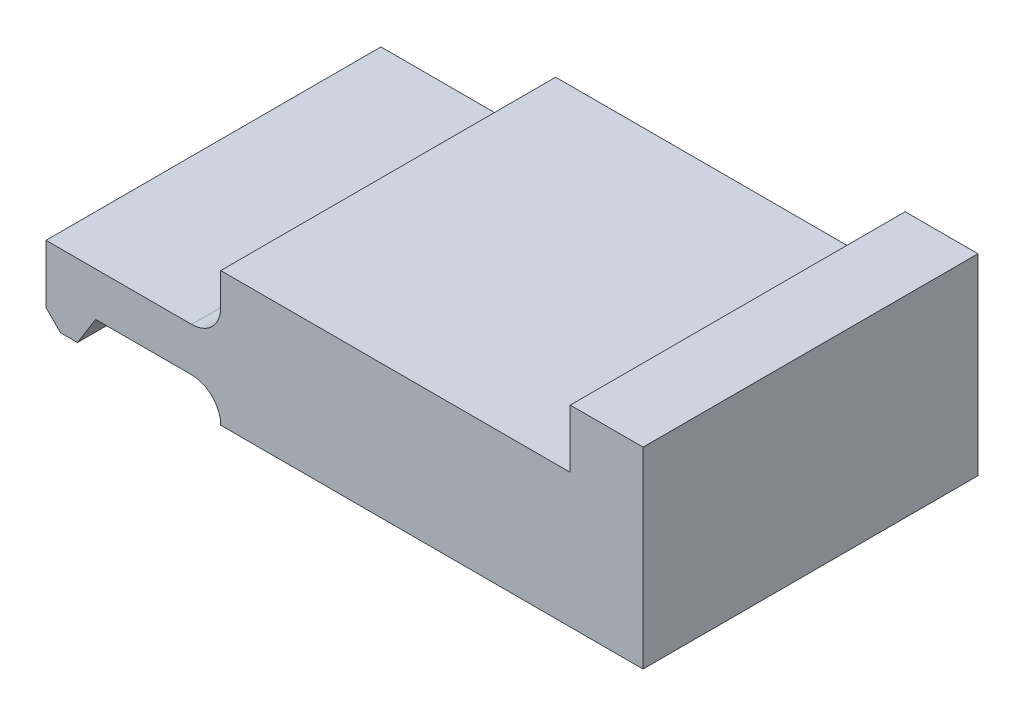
SolidWorks part; units mm, degrees
ref_plane "Front Plane" through (0, 0, 0) normal (0, 0, 1) x (1, 0, 0)
ref_plane "Top Plane" through (0, 0, 0) normal (0, 1, 0) x (1, 0, 0)
ref_plane "Right Plane" through (0, 0, 0) normal (1, 0, 0) x (0, 0, -1)
sketch "Esquisse1" plane through (0, 0, 0) normal (0, 0, 1) x (1, 0, 0)
  line L0 (18, 4.6) -> (6, 4.6)
  line L1 (0, 2.5) -> (0, 0.5)
  line L2 (6, 4.6) -> (6, 3.5)
  line L4 (6, 0) -> (18, 0)
  line L5 (18, 0) -> (18, 4.6)
  line L6 (1.7043, 1) -> (5, 1)
  line L7 (5, 2.5) -> (0, 2.5)
  line L8 (0, 0.5) -> (0.5, 0)
  line L9 (0.5, 0) -> (1.0802, 0)
  line L10 (1.0802, 0) -> (1.7043, 1)
  arc A0 (5, 1) -> (6, 0) centre (5, 0) cw
  arc A3 (5, 2.5) -> (6, 3.5) centre (5, 3.5) ccw
  point P2 (1.7958, 1.1259)
  point P5 (0, 0.5088)
  point P6 (1.1872, 0)
  point P13 (0, 0)
  point P18 (0, 0)
  point P19 (1.4606, 1)
  point P20 (1.0802, 0)
  point P21 (0.2851, 0)
  point P22 (0, 0.4253)
  point P23 (1.7043, 1)
  dimension "D6" = 45
  dimension "D2" = 6
  dimension "D4" = 1.5
  dimension "D5" = 1
  dimension "D7" = 0.5
  dimension "D1" = 4.6
  dimension "D3" = 18
extrude "Boss.-Extru.1" add sketch "Esquisse1" along normal mid plane 11.5
sketch "Esquisse2" plane through (18, 0, 0) normal (1, 0, 0) x (0, 0, -1)
  line L0 (-5.75, 4.6) -> (5.75, 4.6) construction
  line L1 (5.75, 0) -> (-5.75, 0)
  line L2 (5.75, 0) -> (5.75, 6.6)
  line L3 (5.75, 6.6) -> (-5.75, 6.6)
  line L4 (-5.75, 0) -> (-5.75, 6.6)
  dimension "D1" = 2
extrude "Boss.-Extru.2" add sketch "Esquisse2" along normal blind 2.5
